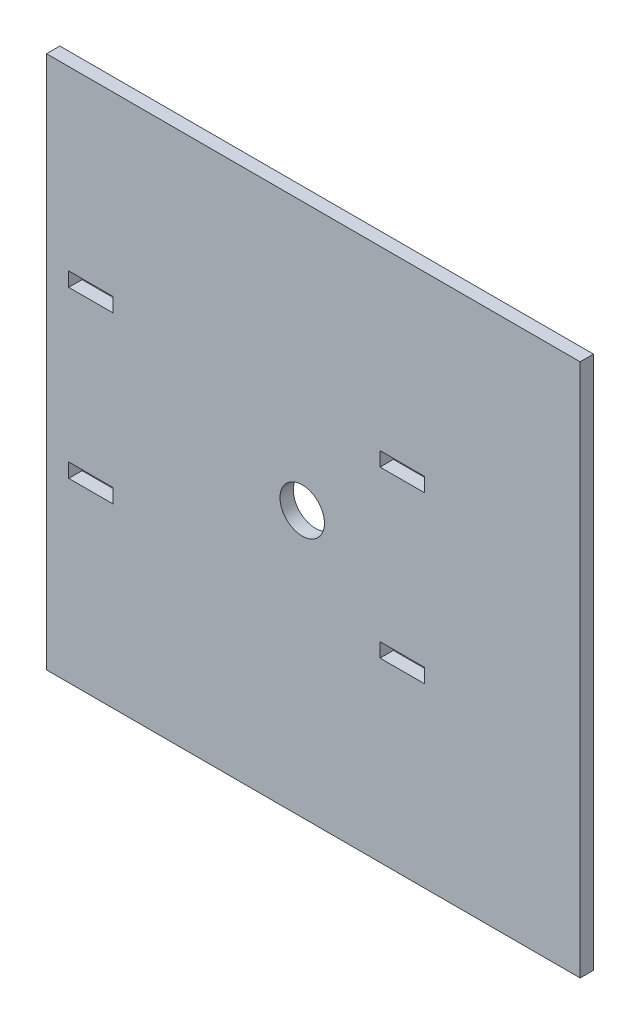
SolidWorks part; units mm, degrees
ref_plane "Plan de face" through (0, 0, 0) normal (0, 0, 1) x (1, 0, 0)
ref_plane "Plan de dessus" through (0, 0, 0) normal (0, 1, 0) x (1, 0, 0)
ref_plane "Plan de droite" through (0, 0, 0) normal (1, 0, 0) x (0, 0, -1)
sketch "Esquisse1" plane through (0, 0, 0) normal (0, 0, 1) x (1, 0, 0)
  line L0 (0, 0) -> (64.3095, 0) construction
  line L1 (-28.4006, 60) -> (91.5994, 60)
  line L2 (-28.4006, 60) -> (-28.4006, -60)
  line L3 (-28.4006, -60) -> (91.5994, -60)
  line L4 (91.5994, 60) -> (91.5994, -60)
  line L5 (56.5994, 20.2) -> (46.5994, 20.2)
  line L6 (56.5994, 20.2) -> (56.5994, 17)
  line L7 (56.5994, 17) -> (46.5994, 17)
  line L8 (46.5994, 20.2) -> (46.5994, 17)
  line L9 (-13.4006, 20.2) -> (-23.4006, 20.2)
  line L10 (-13.4006, 20.2) -> (-13.4006, 17)
  line L11 (-13.4006, 17) -> (-23.4006, 17)
  line L12 (-23.4006, 20.2) -> (-23.4006, 17)
  line L13 (56.5994, -20.2) -> (56.5994, -17)
  line L14 (56.5994, -17) -> (46.5994, -17)
  line L15 (56.5994, -20.2) -> (46.5994, -20.2)
  line L16 (46.5994, -20.2) -> (46.5994, -17)
  line L17 (-13.4006, -20.2) -> (-13.4006, -17)
  line L18 (-13.4006, -17) -> (-23.4006, -17)
  line L19 (-13.4006, -20.2) -> (-23.4006, -20.2)
  line L20 (-23.4006, -20.2) -> (-23.4006, -17)
  dimension "D1" = 10
  dimension "D2" = 10
  dimension "D3" = 60
  dimension "D4" = 120
  dimension "D5" = 3.2
  dimension "D6" = 120
  dimension "D7" = 60
  dimension "D8" = 17
  dimension "D9" = 5
extrude "Boss.-Extru.1" add sketch "Esquisse1" along normal blind 3
sketch "Esquisse2" plane through (0, 0, 0) normal (0, 0, -1) x (-1, 0, 0)
  circle A0 centre (-29.0994, -0.2) radius 5
  dimension "D1" = 10
extrude "Enlèv. mat.-Extru.1" cut sketch "Esquisse2" against normal blind 10
